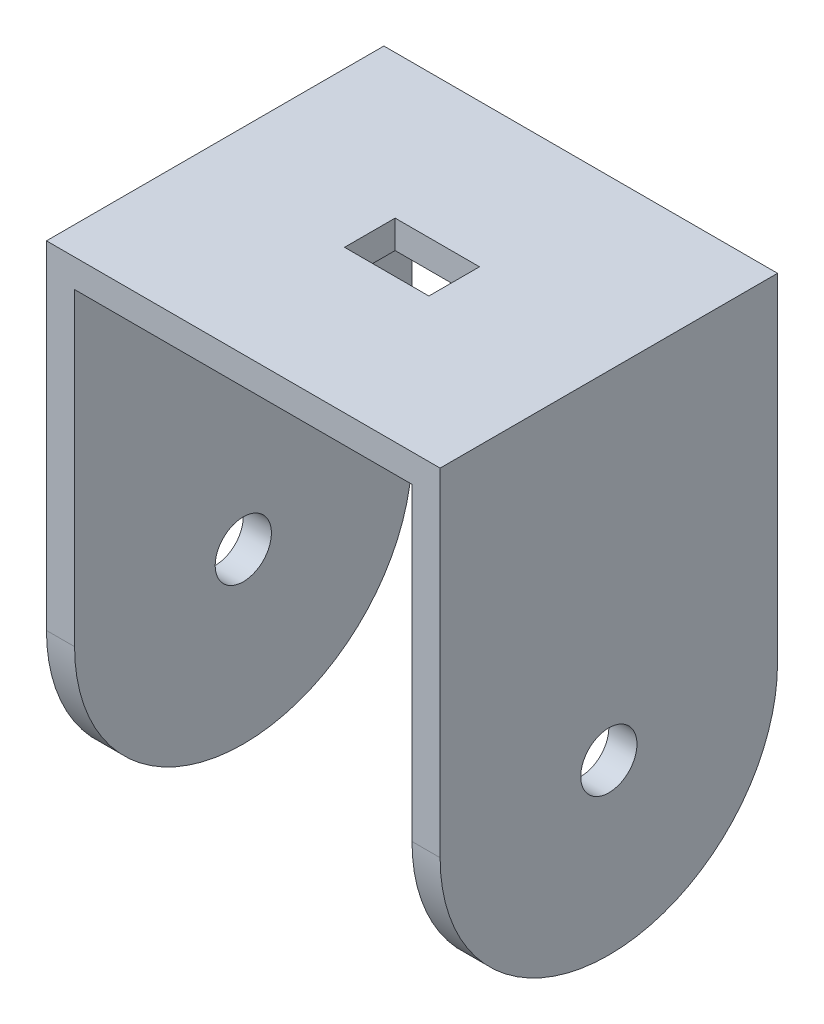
SolidWorks part; units mm, degrees
ref_plane "Front Plane" through (0, 0, 0) normal (0, 0, 1) x (1, 0, 0)
ref_plane "Top Plane" through (0, 0, 0) normal (0, 1, 0) x (1, 0, 0)
ref_plane "Right Plane" through (0, 0, 0) normal (1, 0, 0) x (0, 0, -1)
sketch "Sketch2" plane through (0, 0, 0) normal (0, 1, 0) x (1, 0, 0)
  line L1 (-35, 30) -> (35, 30)
  line L2 (-35, 30) -> (-35, -30)
  line L3 (-35, -30) -> (35, -30)
  line L4 (35, 30) -> (35, -30)
  line L5 (-35, 30) -> (35, -30) construction
  line L6 (-35, -30) -> (35, 30) construction
  point P0 (0, 0)
  dimension "D1" = 70
  dimension "D2" = 60
extrude "Boss-Extrude1" add sketch "Sketch2" against normal blind 5
sketch "Sketch3" plane through (35, 0, 0) normal (1, 0, 0) x (0, 0, -1)
  line L0 (-30, 0) -> (-30, -60)
  line L1 (0, 2.75) -> (0, -2.75) construction
  line L2 (30, 0) -> (30, -60)
  line L3 (-30, 0) -> (30, 0)
  arc A0 (-30, -60) -> (30, -60) centre (0, -60) ccw
  dimension "D1" = 60
extrude "Boss-Extrude2" add sketch "Sketch3" against normal blind 5
mirror "Mirror1" about plane through (0, 0, 0) normal (1, 0, 0) of "Boss-Extrude2"
sketch "Sketch4" plane through (35, 0, 0) normal (1, 0, 0) x (0, 0, -1)
  circle A0 centre (0, -60) radius 5
extrude "Cut-Extrude1" cut sketch "Sketch4" against normal through all
sketch "Sketch5" plane through (0, 0, 0) normal (0, 1, 0) x (1, 0, 0)
  line L1 (-7.5, 4.5) -> (7.5, 4.5)
  line L2 (-7.5, 4.5) -> (-7.5, -4.5)
  line L3 (-7.5, -4.5) -> (7.5, -4.5)
  line L4 (7.5, 4.5) -> (7.5, -4.5)
  line L5 (-7.5, 4.5) -> (7.5, -4.5) construction
  line L6 (-7.5, -4.5) -> (7.5, 4.5) construction
  point P0 (0, 0)
  dimension "D1" = 15
  dimension "D2" = 9
extrude "Cut-Extrude2" cut sketch "Sketch5" against normal blind 10
